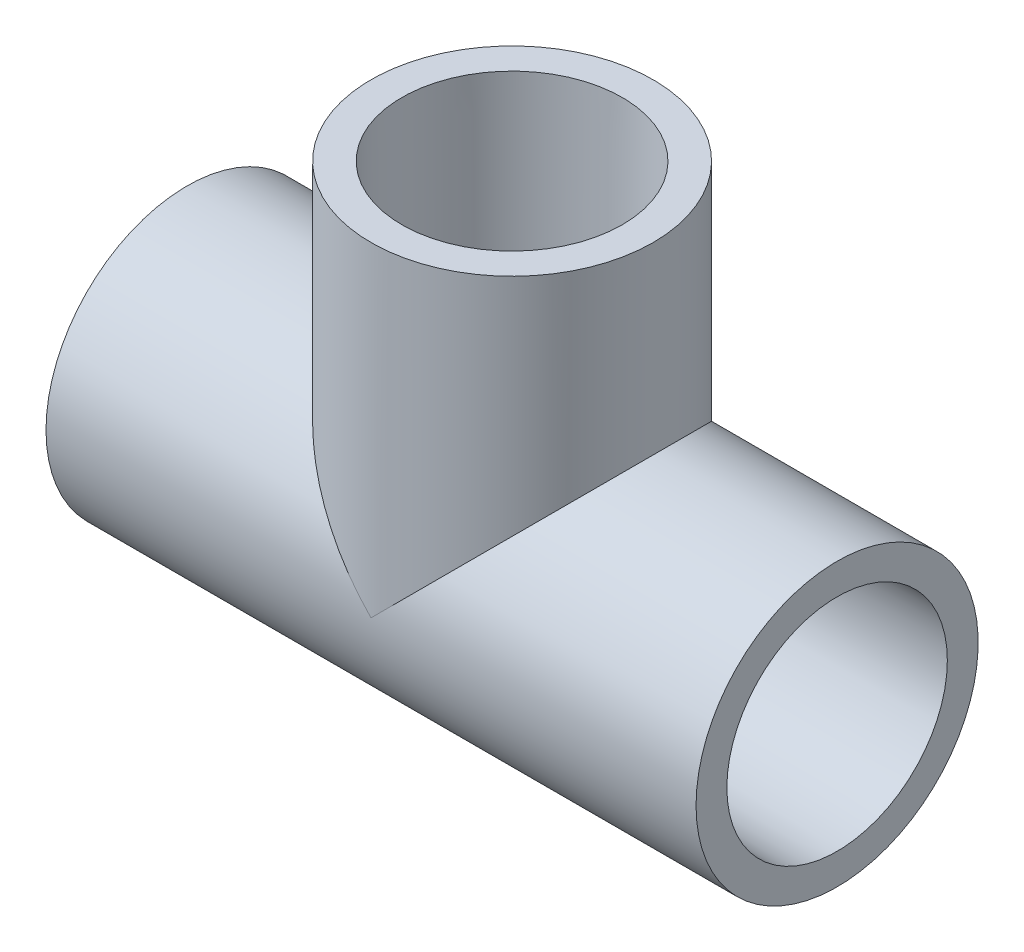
SolidWorks part; units mm, degrees
ref_plane "Front Plane" through (0, 0, 0) normal (0, 0, 1) x (1, 0, 0)
ref_plane "Top Plane" through (0, 0, 0) normal (0, 1, 0) x (1, 0, 0)
ref_plane "Right Plane" through (0, 0, 0) normal (1, 0, 0) x (0, 0, -1)
sketch "Sketch0" plane through (0, 0, 0) normal (0, 0, 1) x (1, 0, 0)
  line L0 (-31.75, 0) -> (0, 0) construction
  line L1 (0, 0) -> (0, 31.75) construction
  line L2 (-12.7, 0) -> (0, 0) construction
  line L3 (0, 0) -> (0, 12.7) construction
  line L4 (-31.75, 13.7795) -> (-31.75, -13.7795) construction
  line L5 (-12.7, 10.6172) -> (-31.75, 10.7696) construction
  line L6 (-12.7, 10.6172) -> (-12.7, -10.6172) construction
  line L7 (-12.7, -10.6172) -> (-31.75, -10.7696) construction
  line L8 (-31.75, 10.7696) -> (-31.75, -10.7696) construction
  line L9 (-13.7795, 31.75) -> (13.7795, 31.75) construction
  line L10 (-10.7696, 31.75) -> (10.7696, 31.75) construction
  line L11 (10.7696, 31.75) -> (10.6172, 12.7) construction
  line L12 (10.6172, 12.7) -> (-10.6172, 12.7) construction
  line L13 (-10.6172, 12.7) -> (-10.7696, 31.75) construction
  line L14 (-12.7, 7.8994) -> (-12.7, -7.8994) construction
  line L15 (-31.75, 0) -> (-12.7, 0) construction
  line L16 (0, 31.75) -> (0, 12.7) construction
  line L17 (0, 0) -> (12.7, 0) construction
  line L18 (-7.8994, 12.7) -> (7.8994, 12.7) construction
  line L19 (12.7, 0) -> (31.75, 0) construction
  dimension "H" = 31.75
  dimension "G" = 12.7
  dimension "M" = 27.559
  dimension "OD A" = 21.5392
  dimension "OD B" = 21.2344
  dimension "ID" = 15.7988
  dimension "H3" = 31.75
sketch "Sketch1" plane through (0, 0, 0) normal (0, 0, 1) x (1, 0, 0)
  line L0 (-31.75, 0) -> (0, 0) construction
  line L1 (-31.75, 0) -> (0, 0) construction
  line L2 (0, 0) -> (0, -13.7795) construction
  line L3 (-31.75, -13.7795) -> (-12.7, -13.7795)
  line L4 (-31.75, -13.7795) -> (-31.75, -10.7696)
  line L5 (-31.75, -10.7696) -> (-12.7, -10.6172)
  line L6 (-12.7, -13.7795) -> (-12.7, -10.6172)
  line L7 (-12.7, -13.7795) -> (0, -13.7795) construction
  line L8 (31.75, -10.7696) -> (12.7, -10.6172)
  line L9 (31.75, -13.7795) -> (31.75, -10.7696)
  line L10 (12.7, -13.7795) -> (12.7, -10.6172)
  line L11 (31.75, -13.7795) -> (12.7, -13.7795)
revolve "Revolve1" add sketch "Sketch1" angle 360 about L1
sketch "Sketch2" plane through (0, 0, 0) normal (0, 0, 1) x (1, 0, 0)
  line L0 (10.7696, 31.75) -> (10.6172, 12.7)
  line L1 (10.6172, 12.7) -> (13.7795, 12.7)
  line L2 (13.7795, 12.7) -> (13.7795, 31.75)
  line L3 (13.7795, 31.75) -> (10.7696, 31.75)
  line L4 (0, 0) -> (0, 31.75) construction
  line L5 (0, 0) -> (0, 31.75) construction
revolve "Revolve2" add sketch "Sketch2" angle 360 about L5
sketch "Sketch3" plane through (-12.7, 0, 0) normal (1, 0, 0) x (0, 0, -1)
  circle A0 centre (0, 0) radius 7.8994
  circle A1 centre (0, 0) radius 13.7795
sketch "Sketch4" plane through (-12.7, 0, 0) normal (1, 0, 0) x (0, 0, -1)
  circle A0 centre (0, 0) radius 13.7795 construction
  circle A1 centre (0, 0) radius 13.7795
extrude "Boss-Extrude1" add sketch "Sketch4" along normal up to vertex (25.4 mm away)
sketch "Sketch5" plane through (0, 12.7, 0) normal (0, -1, 0) x (1, 0, 0)
  circle A0 centre (0, 0) radius 13.7795 construction
  circle A1 centre (0, 0) radius 13.7795
extrude "Boss-Extrude2" add sketch "Sketch5" along normal up to vertex (12.7 mm away)
sketch "Sketch6" plane through (0, 0, 0) normal (0, 0, 1) x (1, 0, 0)
  line L0 (-31.75, -10.7696) -> (-12.7, -10.6172)
  line L1 (-12.7, -10.6172) -> (-12.7, -7.8994)
  line L2 (-12.7, -7.8994) -> (12.7, -7.8994)
  line L3 (12.7, -10.6172) -> (12.7, 9.1728) construction
  line L4 (0, -7.8994) -> (0, 0) construction
  line L5 (12.7, -10.6172) -> (12.7, -7.8994)
  line L6 (31.75, -10.7696) -> (31.75, 10.7696) construction
  line L7 (31.75, -13.7795) -> (31.75, 13.7795) construction
  line L8 (31.75, -10.7696) -> (31.75, 0)
  line L9 (31.75, 0) -> (-31.75, 0)
  line L10 (-31.75, 0) -> (-31.75, -10.7696)
  line L11 (31.75, -10.7696) -> (12.7, -10.6172)
revolve "Cut-Revolve1" cut sketch "Sketch6" angle 360 about L9
sketch "Sketch7" plane through (0, 0, 0) normal (0, 0, 1) x (1, 0, 0)
  line L0 (10.7696, 31.75) -> (10.6172, 12.7)
  line L1 (10.6172, 12.7) -> (7.8994, 12.7)
  line L2 (7.8994, 12.7) -> (7.8994, 0)
  line L3 (0, 0) -> (12.7, 0) construction
  line L4 (7.8994, 0) -> (0, 0)
  line L5 (0, 0) -> (0, 31.75)
  line L6 (-13.7795, 31.75) -> (13.7795, 31.75) construction
  line L7 (0, 31.75) -> (10.7696, 31.75)
revolve "Cut-Revolve2" cut sketch "Sketch7" angle 360 about L5
